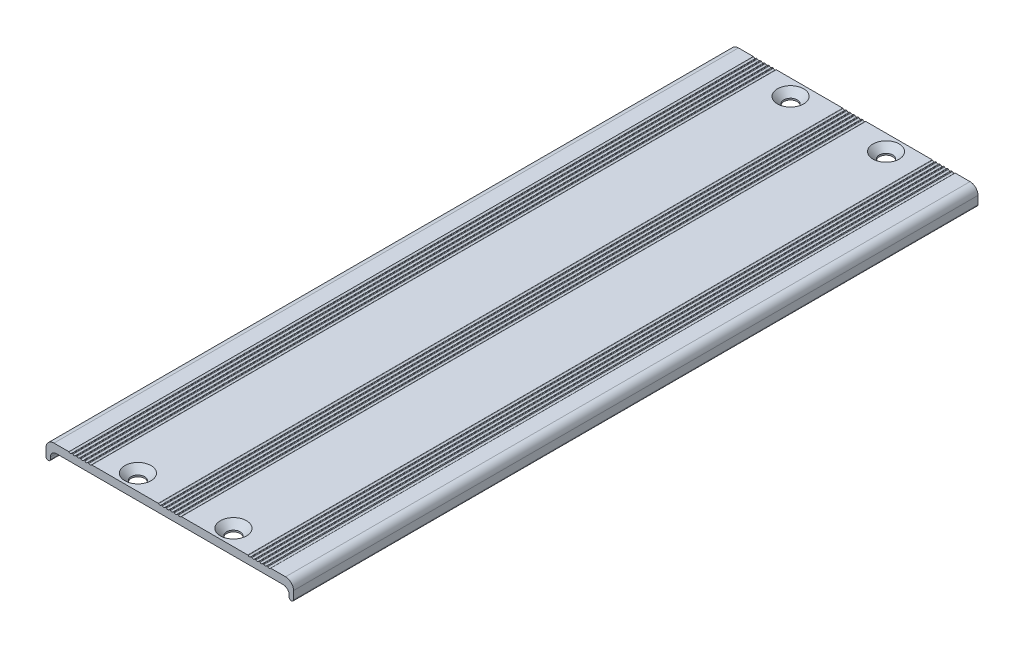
SolidWorks part; units mm, degrees
ref_plane "前视基准面" through (0, 0, 0) normal (0, 0, 1) x (1, 0, 0)
ref_plane "上视基准面" through (0, 0, 0) normal (0, 1, 0) x (1, 0, 0)
ref_plane "右视基准面" through (0, 0, 0) normal (1, 0, 0) x (0, 0, -1)
sketch "Model" plane through (0, 0, 0) normal (0, 0, 1) x (1, 0, 0)
  line L0 (1.5332, 1.262) -> (1.6332, 1.262)
  line L1 (1.0332, 1.762) -> (1.0332, 3.762)
  line L2 (57.4796, 5.762) -> (61.2332, 5.762)
  line L3 (35.0431, 5.762) -> (51.7233, 5.762)
  line L4 (62.1332, 1.762) -> (62.1332, 2.262)
  line L5 (2.1332, 1.762) -> (2.1332, 2.262)
  line L6 (12.5431, 5.762) -> (29.2233, 5.762)
  line L7 (3.0332, 5.762) -> (6.7868, 5.762)
  line L8 (3.6332, 3.762) -> (60.6332, 3.762)
  line L9 (63.2332, 3.762) -> (63.2332, 1.762)
  line L10 (62.6332, 1.262) -> (62.7332, 1.262)
  line L11 (56.7868, 5.762) -> (56.5431, 5.762)
  line L12 (7.7233, 5.762) -> (7.5431, 5.762)
  line L13 (30.2233, 5.762) -> (30.0431, 5.762)
  line L14 (11.7233, 5.762) -> (11.5431, 5.762)
  line L15 (34.2233, 5.762) -> (34.0431, 5.762)
  line L16 (52.7233, 5.762) -> (52.5431, 5.762)
  line L17 (55.7233, 5.762) -> (55.5431, 5.762)
  line L18 (8.7233, 5.762) -> (8.5431, 5.762)
  line L19 (31.2233, 5.762) -> (31.0431, 5.762)
  line L20 (10.7233, 5.762) -> (10.5431, 5.762)
  line L21 (33.2233, 5.762) -> (33.0431, 5.762)
  line L22 (53.7233, 5.762) -> (53.5431, 5.762)
  line L23 (54.7233, 5.762) -> (54.5431, 5.762)
  line L24 (9.7233, 5.762) -> (9.5431, 5.762)
  line L25 (32.2233, 5.762) -> (32.0431, 5.762)
  arc A0 (1.0332, 1.762) -> (1.5332, 1.262) centre (1.5332, 1.762) ccw
  arc A1 (1.6332, 1.262) -> (2.1332, 1.762) centre (1.6332, 1.762) ccw
  arc A2 (3.6332, 3.762) -> (2.1332, 2.262) centre (3.6332, 2.262) ccw
  arc A3 (62.1332, 2.262) -> (60.6332, 3.762) centre (60.6332, 2.262) ccw
  arc A4 (63.2332, 3.762) -> (61.2332, 5.762) centre (61.2332, 3.762) ccw
  arc A5 (3.0332, 5.762) -> (1.0332, 3.762) centre (3.0332, 3.762) ccw
  arc A6 (29.3179, 5.7159) -> (29.2233, 5.762) centre (29.2233, 5.642) ccw
  arc A7 (12.5431, 5.762) -> (12.4485, 5.7159) centre (12.5431, 5.642) ccw
  arc A8 (6.7868, 5.762) -> (7.4485, 5.7159) centre (7.1332, 5.962) ccw
  arc A9 (62.7332, 1.262) -> (63.2332, 1.762) centre (62.7332, 1.762) ccw
  arc A10 (56.7868, 5.762) -> (57.4796, 5.762) centre (57.1332, 5.962) ccw
  arc A11 (35.0431, 5.762) -> (34.9485, 5.7159) centre (35.0431, 5.642) ccw
  arc A12 (51.8179, 5.7159) -> (51.7233, 5.762) centre (51.7233, 5.642) ccw
  arc A13 (62.1332, 1.762) -> (62.6332, 1.262) centre (62.6332, 1.762) ccw
  arc A14 (29.3179, 5.7159) -> (29.9485, 5.7159) centre (29.6332, 5.962) ccw
  arc A15 (11.8179, 5.7159) -> (12.4485, 5.7159) centre (12.1332, 5.962) ccw
  arc A16 (7.5431, 5.762) -> (7.4485, 5.7159) centre (7.5431, 5.642) ccw
  arc A17 (34.3179, 5.7159) -> (34.9485, 5.7159) centre (34.6332, 5.962) ccw
  arc A18 (51.8179, 5.7159) -> (52.4485, 5.7159) centre (52.1332, 5.962) ccw
  arc A19 (30.0431, 5.762) -> (29.9485, 5.7159) centre (30.0431, 5.642) ccw
  arc A20 (11.8179, 5.7159) -> (11.7233, 5.762) centre (11.7233, 5.642) ccw
  arc A21 (56.5431, 5.762) -> (56.4485, 5.7159) centre (56.5431, 5.642) ccw
  arc A22 (34.3179, 5.7159) -> (34.2233, 5.762) centre (34.2233, 5.642) ccw
  arc A23 (52.5431, 5.762) -> (52.4485, 5.7159) centre (52.5431, 5.642) ccw
  arc A24 (7.8179, 5.7159) -> (7.7233, 5.762) centre (7.7233, 5.642) ccw
  arc A25 (55.8179, 5.7159) -> (56.4485, 5.7159) centre (56.1332, 5.962) ccw
  arc A26 (30.3179, 5.7159) -> (30.2233, 5.762) centre (30.2233, 5.642) ccw
  arc A27 (11.5431, 5.762) -> (11.4485, 5.7159) centre (11.5431, 5.642) ccw
  arc A28 (7.8179, 5.7159) -> (8.4485, 5.7159) centre (8.1332, 5.962) ccw
  arc A29 (55.8179, 5.7159) -> (55.7233, 5.762) centre (55.7233, 5.642) ccw
  arc A30 (34.0431, 5.762) -> (33.9485, 5.7159) centre (34.0431, 5.642) ccw
  arc A31 (52.8179, 5.7159) -> (52.7233, 5.762) centre (52.7233, 5.642) ccw
  arc A32 (30.3179, 5.7159) -> (30.9485, 5.7159) centre (30.6332, 5.962) ccw
  arc A33 (10.8179, 5.7159) -> (11.4485, 5.7159) centre (11.1332, 5.962) ccw
  arc A34 (8.5431, 5.762) -> (8.4485, 5.7159) centre (8.5431, 5.642) ccw
  arc A35 (33.3179, 5.7159) -> (33.9485, 5.7159) centre (33.6332, 5.962) ccw
  arc A36 (52.8179, 5.7159) -> (53.4485, 5.7159) centre (53.1332, 5.962) ccw
  arc A37 (31.0431, 5.762) -> (30.9485, 5.7159) centre (31.0431, 5.642) ccw
  arc A38 (10.8179, 5.7159) -> (10.7233, 5.762) centre (10.7233, 5.642) ccw
  arc A39 (55.5431, 5.762) -> (55.4485, 5.7159) centre (55.5431, 5.642) ccw
  arc A40 (33.3179, 5.7159) -> (33.2233, 5.762) centre (33.2233, 5.642) ccw
  arc A41 (53.5431, 5.762) -> (53.4485, 5.7159) centre (53.5431, 5.642) ccw
  arc A42 (8.8179, 5.7159) -> (8.7233, 5.762) centre (8.7233, 5.642) ccw
  arc A43 (54.8179, 5.7159) -> (55.4485, 5.7159) centre (55.1332, 5.962) ccw
  arc A44 (31.3179, 5.7159) -> (31.2233, 5.762) centre (31.2233, 5.642) ccw
  arc A45 (10.5431, 5.762) -> (10.4485, 5.7159) centre (10.5431, 5.642) ccw
  arc A46 (8.8179, 5.7159) -> (9.4485, 5.7159) centre (9.1332, 5.962) ccw
  arc A47 (54.8179, 5.7159) -> (54.7233, 5.762) centre (54.7233, 5.642) ccw
  arc A48 (33.0431, 5.762) -> (32.9485, 5.7159) centre (33.0431, 5.642) ccw
  arc A49 (53.8179, 5.7159) -> (53.7233, 5.762) centre (53.7233, 5.642) ccw
  arc A50 (31.3179, 5.7159) -> (31.9485, 5.7159) centre (31.6332, 5.962) ccw
  arc A51 (9.8179, 5.7159) -> (10.4485, 5.7159) centre (10.1332, 5.962) ccw
  arc A52 (9.5431, 5.762) -> (9.4485, 5.7159) centre (9.5431, 5.642) ccw
  arc A53 (32.3179, 5.7159) -> (32.9485, 5.7159) centre (32.6332, 5.962) ccw
  arc A54 (53.8179, 5.7159) -> (54.4485, 5.7159) centre (54.1332, 5.962) ccw
  arc A55 (32.0431, 5.762) -> (31.9485, 5.7159) centre (32.0431, 5.642) ccw
  arc A56 (9.8179, 5.7159) -> (9.7233, 5.762) centre (9.7233, 5.642) ccw
  arc A57 (54.5431, 5.762) -> (54.4485, 5.7159) centre (54.5431, 5.642) ccw
  arc A58 (32.3179, 5.7159) -> (32.2233, 5.762) centre (32.2233, 5.642) ccw
extrude "凸台-拉伸1" add sketch "Model" along normal mid plane 172
hole_wizard "打孔尺寸(%根据十字)槽半沉头木螺钉的类型1" positions "草图2" profile "草图3" countersink size "M3" standard "GB"
sketch "草图2" plane through (0, 5.762, 0) normal (0, 1, 0) x (1, 0, 0)
  line L0 (32.1332, 86) -> (32.1332, -108.6326) construction
  line L1 (32.2233, 86) -> (32.0431, 86) construction
  line L3 (29.2233, 86) -> (12.5431, 86) construction
  line L4 (29.2233, -86) -> (12.5431, -86) construction
  point P0 (20.1332, -82)
  point P2 (44.1332, -82)
  point P4 (20.1332, 82)
  point P6 (44.1332, 82)
  dimension "D1" = 24
  dimension "D2" = 4
  dimension "D3" = 4
sketch "草图3" plane through (20.1332, 5.762, 82) normal (1, 0, 0) x (0, 0, 1)
  line L0 (0, 0) -> (0, 4.5)
  line L1 (0, 4.5) -> (1.7, 4.5)
  line L2 (1.7, 4.5) -> (1.7, 1.6)
  line L3 (1.7, 1.6) -> (3.3, 0)
  line L5 (3.3, 0) -> (0, 0)
  line L6 (-1.7, 1.6) -> (-3.3, 0) construction
  line L11 (0, -6.35) -> (0, 107.95) construction
  dimension "通孔孔直径" = 3.4
  dimension "通孔孔深度" = 4.5
  dimension "近端锥形沉头孔直径" = 6.6
  dimension "近端锥形沉头孔角度" = 90
